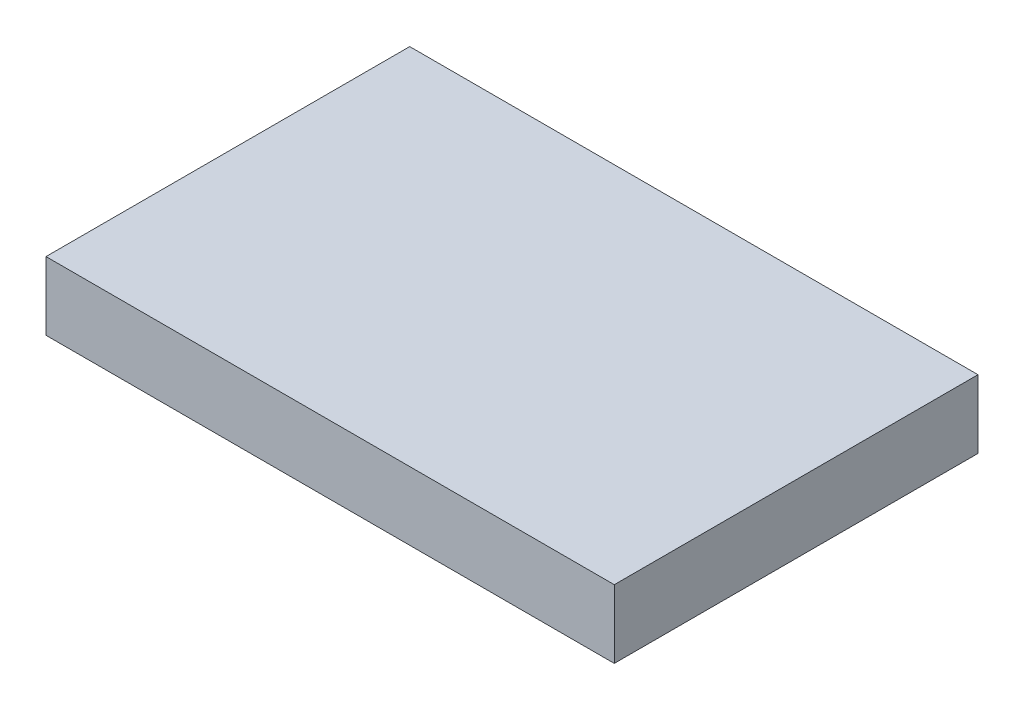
SolidWorks part; units mm, degrees
ref_plane "前视基准面" through (0, 0, 0) normal (0, 0, 1) x (1, 0, 0)
ref_plane "上视基准面" through (0, 0, 0) normal (0, 1, 0) x (1, 0, 0)
ref_plane "右视基准面" through (0, 0, 0) normal (1, 0, 0) x (0, 0, -1)
other "Configuration Table"
sketch "草图1" plane through (0, 0, 0) normal (0, 1, 0) x (1, 0, 0)
  line L1 (-12.5, -8) -> (12.5, -8)
  line L2 (-12.5, -8) -> (-12.5, 8)
  line L3 (-12.5, 8) -> (12.5, 8)
  line L4 (12.5, -8) -> (12.5, 8)
  line L5 (-12.5, -8) -> (12.5, 8) construction
  line L6 (-12.5, 8) -> (12.5, -8) construction
  point P0 (0, 0)
  dimension "D1" = 25
  dimension "D2" = 16
extrude "凸台-拉伸1" add sketch "草图1" along normal blind 3
